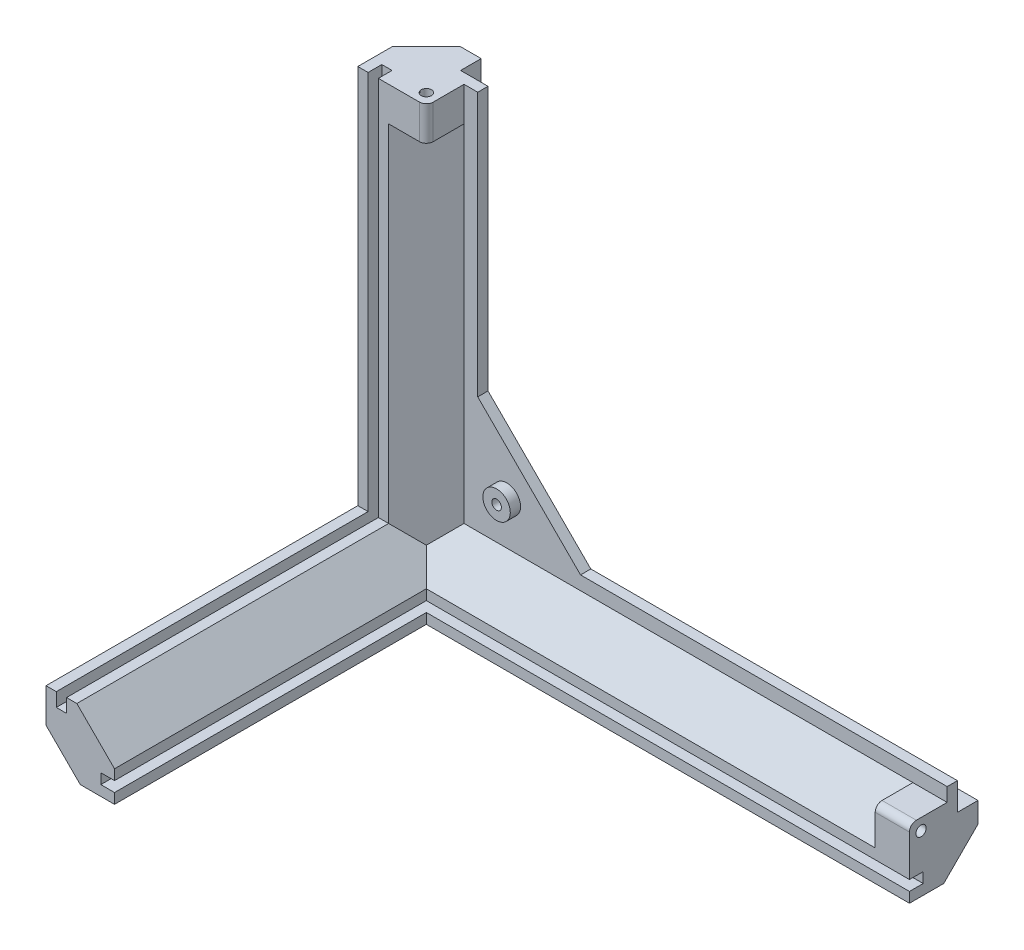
SolidWorks part; units mm, degrees
ref_plane "Front Plane" through (0, 0, 0) normal (0, 0, 1) x (1, 0, 0)
ref_plane "Top Plane" through (0, 0, 0) normal (0, 1, 0) x (1, 0, 0)
ref_plane "Right Plane" through (0, 0, 0) normal (1, 0, 0) x (0, 0, -1)
sketch "Sketch1" plane through (0, 0, 0) normal (0, 1, 0) x (1, 0, 0)
  line L0 (-60.0579, 3.4523) -> (-50.0579, 3.4523) construction
  line L1 (-50.0579, 3.4523) -> (-50.0579, 13.4523) construction
  line L2 (-60.0579, 3.4523) -> (-50.0579, 13.4523)
  line L3 (-50.0579, 13.4523) -> (-40.0579, 13.4523)
  line L4 (-40.0579, 13.4523) -> (-40.0579, 10.4523)
  line L5 (-40.0579, 10.4523) -> (-44.0579, 10.4523)
  line L6 (-44.0579, 10.4523) -> (-44.0579, 7.4523)
  line L7 (-44.0579, 7.4523) -> (-40.0579, 7.4523)
  line L8 (-40.0579, 7.4523) -> (-40.0579, 4.4523)
  line L9 (-60.0579, 3.4523) -> (-60.0579, -6.5477)
  line L10 (-60.0579, -6.5477) -> (-57.0579, -6.5477)
  line L11 (-57.0579, -6.5477) -> (-57.0579, -2.5477)
  line L12 (-57.0579, -2.5477) -> (-54.0579, -2.5477)
  line L13 (-54.0579, -2.5477) -> (-54.0579, -6.5477)
  line L14 (-54.0579, -6.5477) -> (-51.0579, -6.5477)
  line L15 (-40.0579, 4.4523) -> (-51.0579, -6.5477)
extrude "Boss-Extrude1" add sketch "Sketch1" along normal blind 111
sketch "Sketch2" plane through (0, 0, 6.5477) normal (0, 0, 1) x (1, 0, 0)
  line L0 (-54.0579, 0) -> (-54.0579, -3.2274) construction
  line L1 (-57.0579, 0) -> (-57.0579, -4)
  line L2 (-57.0579, -4) -> (-54.0579, -4)
  line L3 (-54.0579, -4) -> (-54.0579, 0)
  line L4 (-54.0579, 0) -> (-51.0579, 0)
  line L5 (-57.0579, 0) -> (-60.0579, 0)
  line L6 (-60.0579, 0) -> (-60.0579, -10)
  line L7 (-60.0579, -10) -> (-50.0579, -10) construction
  line L8 (-50.0579, -10) -> (-50.0579, -20) construction
  line L9 (-50.0579, -20) -> (-60.0579, -10)
  line L10 (-50.0579, -20) -> (-40.0579, -20)
  line L11 (-40.0579, -20) -> (-40.0579, -17)
  line L12 (-40.0579, -17) -> (-44.0579, -17)
  line L13 (-44.0579, -17) -> (-44.0579, -14)
  line L14 (-44.0579, -14) -> (-40.0579, -14)
  line L15 (-40.0579, -14) -> (-40.0579, -11)
  line L16 (-40.0579, -11) -> (-51.0579, 0)
extrude "Boss-Extrude2" add sketch "Sketch2" along normal blind 91 separate body
sketch "Sketch3" plane through (-40.0579, 0, 0) normal (1, 0, 0) x (0, 0, -1)
  line L0 (-6.5477, -11) -> (-6.5477, -14)
  line L1 (-6.5477, -14) -> (-2.5477, -14)
  line L2 (-2.5477, -14) -> (-2.5477, -17)
  line L3 (-2.5477, -17) -> (-6.5477, -17)
  line L4 (-6.5477, -17) -> (-6.5477, -20)
  line L5 (-6.5477, -20) -> (3.4523, -20)
  line L6 (7.4523, 0) -> (7.4523, -4)
  line L7 (7.4523, -4) -> (10.4523, -4)
  line L8 (10.4523, -4) -> (10.4523, 0)
  line L9 (10.4523, 0) -> (13.4523, 0)
  line L10 (13.4523, 0) -> (13.4523, -10)
  line L11 (13.4523, -10) -> (3.4523, -20)
  line L12 (-6.5477, -11) -> (4.4523, 0)
  line L13 (4.4523, 0) -> (7.4523, 0)
extrude "Boss-Extrude3" add sketch "Sketch3" along normal blind 141 separate body
sketch "Sketch4" plane through (0, 0, -13.4523) normal (0, 0, -1) x (-1, 0, 0)
  line L0 (40.0579, 0) -> (40.0579, -20)
  line L1 (40.0579, -20) -> (60.0579, -20)
  line L2 (60.0579, -20) -> (60.0579, 0)
  line L3 (60.0579, 0) -> (40.0579, 0)
extrude "Boss-Extrude4" add sketch "Sketch4" against normal blind 20
sketch "Sketch5" plane through (0, 0, 6.5477) normal (0, 0, 1) x (1, 0, 0)
  line L0 (-50.0579, -20) -> (-60.0579, -10)
  line L1 (-60.0579, -10) -> (-60.0579, -20)
  line L2 (-60.0579, -20) -> (-50.0579, -20)
extrude "Cut-Extrude1" cut sketch "Sketch5" against normal blind 20
sketch "Sketch6" plane through (0, 0, 0) normal (0, 1, 0) x (1, 0, 0)
  line L0 (-60.0579, 3.4523) -> (-50.0579, 13.4523)
  line L1 (-50.0579, 13.4523) -> (-60.0579, 13.4523)
  line L2 (-60.0579, 13.4523) -> (-60.0579, 3.4523)
extrude "Cut-Extrude2" cut sketch "Sketch6" against normal blind 20
sketch "Sketch7" plane through (-40.0579, 0, 0) normal (1, 0, 0) x (0, 0, -1)
  line L0 (13.4523, -10) -> (3.4523, -20)
  line L1 (3.4523, -20) -> (13.4523, -20)
  line L2 (13.4523, -20) -> (13.4523, -10)
extrude "Cut-Extrude3" cut sketch "Sketch7" against normal blind 20
sketch "Sketch8" plane through (-40.0579, 0, 0) normal (1, 0, 0) x (0, 0, -1)
  line L0 (-6.5477, -14) -> (-2.5477, -14)
  line L1 (-2.5477, -14) -> (-2.5477, -17)
  line L2 (-2.5477, -17) -> (-6.5477, -17)
  line L3 (-6.5477, -17) -> (-6.5477, -14)
extrude "Cut-Extrude4" cut sketch "Sketch8" against normal blind 4
sketch "Sketch9" plane through (-40.0579, 0, 0) normal (1, 0, 0) x (0, 0, -1)
  line L0 (7.4523, 0) -> (10.4523, 0)
  line L1 (10.4523, 0) -> (10.4523, -4)
  line L2 (10.4523, -4) -> (7.4523, -4)
  line L3 (7.4523, -4) -> (7.4523, 0)
extrude "Cut-Extrude5" cut sketch "Sketch9" against normal blind 4
sketch "Sketch10" plane through (0, 0, 0) normal (0, 1, 0) x (1, 0, 0)
  line L0 (-57.0579, -2.5477) -> (-54.0579, -2.5477)
  line L1 (-54.0579, -2.5477) -> (-54.0579, -6.5477)
  line L2 (-54.0579, -6.5477) -> (-57.0579, -6.5477)
  line L3 (-57.0579, -6.5477) -> (-57.0579, -2.5477)
extrude "Cut-Extrude6" cut sketch "Sketch10" against normal blind 4
sketch "Sketch11" plane through (0, 0, 0) normal (0, 1, 0) x (1, 0, 0)
  line L0 (-51.0579, -6.5477) -> (-40.0579, 4.4523)
  line L1 (-40.0579, 4.4523) -> (-40.0579, -6.5477)
  line L2 (-40.0579, -6.5477) -> (-51.0579, -6.5477)
extrude "Cut-Extrude7" cut sketch "Sketch11" against normal blind 11
sketch "Sketch12" plane through (-40.0579, 0, 0) normal (-1, 0, 0) x (0, 0, 1)
  line L0 (6.5477, -11) -> (-4.4523, -11)
  line L1 (-4.4523, -11) -> (-4.4523, 0)
  line L2 (-4.4523, 0) -> (6.5477, -11)
extrude "Boss-Extrude5" add sketch "Sketch12" along normal blind 10
sketch "Sketch13" plane through (0, 0, 6.5477) normal (0, 0, -1) x (-1, 0, 0)
  line L0 (40.0579, -11) -> (51.0579, -11)
  line L1 (51.0579, -11) -> (51.0579, 0)
  line L2 (51.0579, 0) -> (40.0579, -11)
extrude "Boss-Extrude6" add sketch "Sketch13" along normal blind 10
sketch "Sketch14" plane through (0, 0, -10.4523) normal (0, 0, 1) x (1, 0, 0)
  line L0 (-44.0579, -4) -> (-44.0579, 111)
  line L1 (-44.0579, 111) -> (-40.0579, 111)
  line L2 (-40.0579, 111) -> (-40.0579, 0)
  line L3 (-40.0579, 0) -> (100.9421, 0)
  line L4 (100.9421, 0) -> (100.9421, -4)
  line L5 (100.9421, -4) -> (-44.0579, -4)
extrude "Cut-Extrude8" cut sketch "Sketch14" against normal blind 10
sketch "Sketch15" plane through (0, 0, 0) normal (0, 1, 0) x (1, 0, 0)
  line L0 (-40.0579, 4.4523) -> (-40.0579, 7.4523)
  line L1 (-40.0579, 7.4523) -> (100.9421, 7.4523)
  line L2 (100.9421, 7.4523) -> (100.9421, 4.4523)
  line L3 (100.9421, 4.4523) -> (-40.0579, 4.4523)
extrude "Boss-Extrude7" add sketch "Sketch15" along normal blind 4
sketch "Sketch16" plane through (-40.0579, 0, 0) normal (1, 0, 0) x (0, 0, -1)
  line L0 (4.4523, 4) -> (7.4523, 4)
  line L1 (7.4523, 4) -> (7.4523, 111)
  line L2 (7.4523, 111) -> (4.4523, 111)
  line L3 (4.4523, 111) -> (4.4523, 4)
extrude "Boss-Extrude8" add sketch "Sketch16" along normal blind 4
chamfer "Chamfer1" distance 30 angle 45 1 edges at (-36.0579, 4, -5.9523)
chamfer "Chamfer2" distance 20 angle 45 1 edges at (-44.0579, -4, -10.4523)
sketch "Sketch17" plane through (0, 0, -7.4523) normal (0, 0, -1) x (-1, 0, 0)
  line L0 (34.0579, 6) -> (21.0579, 19) construction
  line L1 (24.0579, -4) -> (44.0579, 16) construction
  line L2 (36.0579, 34) -> (6.0579, 4) construction
  circle A0 centre (27.5579, 12.5) radius 1.4
extrude "Cut-Extrude9" cut sketch "Sketch17" against normal through all
sketch "Sketch20" plane through (0, 111, 0) normal (0, 1, 0) x (1, 0, 0)
  line L0 (-40.0579, 4.4523) -> (-40.0579, -9.5639) construction
  line L5 (-51.0579, -6.5477) -> (-40.0579, -6.5477) construction
  line L6 (-40.0579, 4.4523) -> (-40.0579, -6.5477)
  line L7 (-40.0579, -6.5477) -> (-51.0579, -6.5477)
  line L8 (-51.0579, -6.5477) -> (-40.0579, 4.4523)
  line L9 (-45.5579, -1.0477) -> (-43.4365, -3.1691)
  circle A0 centre (-43.4365, -3.1691) radius 1.5
extrude "Boss-Extrude10" add sketch "Sketch20" against normal blind 10
sketch "Sketch21" plane through (100.9421, 0, 0) normal (1, 0, 0) x (0, 0, -1)
  line L0 (-6.5477, -11) -> (-6.5477, 1.031) construction
  line L1 (4.4523, 0) -> (-6.5477, 0) construction
  line L2 (4.4523, 0) -> (-6.5477, 0)
  line L3 (-6.5477, 0) -> (-6.5477, -11)
  line L4 (-6.5477, -11) -> (4.4523, 0)
  line L5 (-1.0477, -5.5) -> (-3.1691, -3.3787) construction
  circle A0 centre (-3.1691, -3.3787) radius 1.5
extrude "Boss-Extrude11" add sketch "Sketch21" against normal blind 10 contours L4 L2 L3 | A0
fillet "Fillet1" radius 2 2 edges at (95.9421, 0, 6.5477) (-40.0579, 106, 6.5477)
sketch "Esquisse1" plane through (0, 0, -4.4523) normal (0, 0, 1) x (1, 0, 0)
  circle A0 centre (-27.5579, 12.5) radius 1.4
  circle A1 centre (-27.5579, 12.5) radius 4
extrude "Boss.-Extru.1" add sketch "Esquisse1" along normal blind 3
